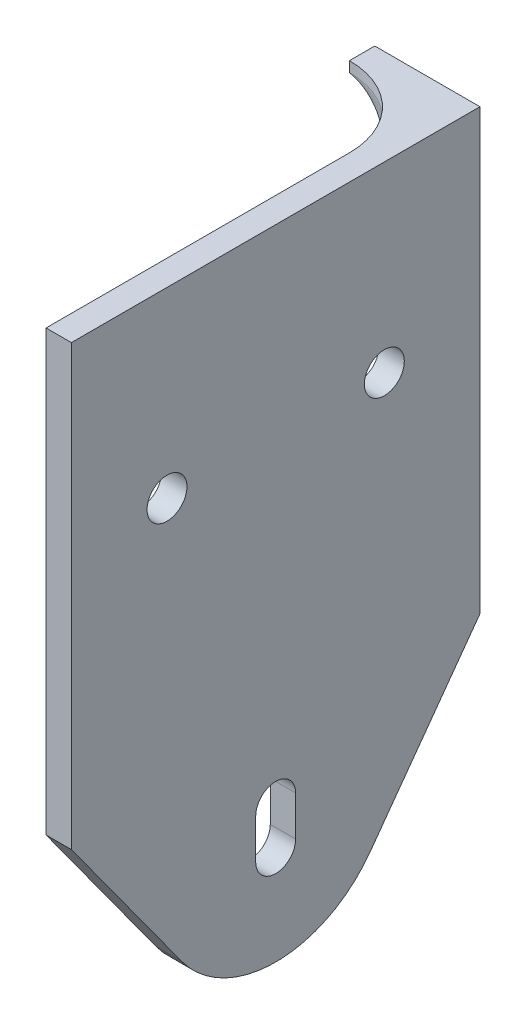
SolidWorks part; units mm, degrees
ref_plane "Front Plane" through (0, 0, 0) normal (0, 0, 1) x (1, 0, 0)
ref_plane "Top Plane" through (0, 0, 0) normal (0, 1, 0) x (1, 0, 0)
ref_plane "Right Plane" through (0, 0, 0) normal (1, 0, 0) x (0, 0, -1)
sketch "Sketch1" plane through (0, 0, 0) normal (0, 0, 1) x (1, 0, 0)
  line L0 (12, -6.3137) -> (12, 6.3)
  line L1 (5.952, 6.3) -> (12, 6.3)
  line L4 (12.1714, -7.3385) -> (12.1693, -6.3137) construction
  line L10 (-10.2132, 6.3) -> (10.2132, 6.3) construction
  line L12 (5.952, 6.3) -> (5.952, -6.3137)
  line L13 (5.952, -6.3137) -> (12.1693, -6.3137)
  line L21 (10.2132, -6.3) -> (11.9128, -6.3137) construction
  line L22 (12, 6.3) -> (15.175, 6.3)
  line L30 (10, -242.35) -> (10, -27.35) construction
  line L31 (10.0001, 6.3) -> (10.2132, 6.3) construction
  line L32 (11.9128, -6.3137) -> (8.8715, -6.3137) construction
  line L33 (12.1693, -6.3137) -> (12, -6.3137) construction
  line L34 (11, -242.35) -> (11, -27.35) construction
  line L35 (0, 6.3) -> (0, 5.1)
  line L36 (11, -73.7) -> (14.175, -73.7)
  line L37 (11, -73.7) -> (11, 6.3)
  line L38 (11, 6.3) -> (14.175, 6.3)
  line L39 (14.175, -73.7) -> (14.175, 6.3)
  line L40 (0, 6.3) -> (5.952, 6.3)
  line L41 (1, 6.3) -> (1, -7.9111)
  line L42 (5.952, -6.3137) -> (1, -6.3)
  arc A1 (10.2132, -6.3) -> (10.2132, 6.3) centre (0, 0) ccw construction
  circle A4 centre (9, 0) radius 1.5
  circle A6 centre (0, 0) radius 5.1
  dimension "D2" = 1
  dimension "D3" = 3.175
  dimension "D4" = 80
  dimension "D5" = 1
extrude "Boss-Extrude1" add sketch "Sketch1" along normal blind 3.175
sketch "Sketch2" plane through (0, 0, 3.175) normal (0, 0, 1) x (1, 0, 0)
  line L1 (11, -73.7) -> (14.175, -73.7)
  line L2 (11, -73.7) -> (11, 6.3)
  line L3 (11, 6.3) -> (14.175, 6.3)
  line L4 (14.175, -73.7) -> (14.175, 6.3)
  dimension "D1" = 80
  dimension "D2" = 3.175
extrude "Boss-Extrude2" add sketch "Sketch2" along normal blind 48
sketch "Sketch3" plane through (14.175, 0, 0) normal (1, 0, 0) x (0, 0, -1)
  line L0 (-51.175, -73.7) -> (0, -73.7) construction
  line L2 (-25.5875, 6.3) -> (-25.5875, -73.7) construction
  line L3 (-51.175, 6.3) -> (0, 6.3) construction
  line L4 (0, -73.7) -> (0, 6.3) construction
  line L5 (0, -17.3318) -> (-11.4305, -62.6693)
  line L8 (-25.5875, -56.6) -> (-25.5875, -61.6) construction
  line L9 (-23.0875, -56.6) -> (-23.0875, -61.6)
  line L10 (-28.0875, -56.6) -> (-28.0875, -61.6)
  line L11 (-51.175, -15.7974) -> (-39.7718, -62.559)
  line L12 (-51.175, -73.7) -> (-51.175, 6.3) construction
  line L23 (0, 6.3) -> (-51.175, 6.3)
  line L24 (-51.175, 6.3) -> (-51.175, -73.7)
  line L25 (-51.175, -73.7) -> (0, -73.7)
  circle A0 centre (-11.9754, -16.5646) radius 12 construction
  circle A1 centre (-39.1996, -16.5646) radius 12 construction
  circle A2 centre (-39.1996, -16.5646) radius 2.5
  circle A3 centre (-11.9754, -16.5646) radius 2.5
  circle A4 centre (-25.5875, -59.1) radius 12 construction
  arc A5 (-23.0875, -56.6) -> (-28.0875, -56.6) centre (-25.5875, -56.6) ccw
  arc A6 (-28.0875, -61.6) -> (-23.0875, -61.6) centre (-25.5875, -61.6) ccw
  circle A7 centre (-25.5875, -59.1) radius 14.6
  point P22 (-25.5875, -59.1)
  dimension "D1" = 24
  dimension "D3" = 5
  dimension "D4" = 5
  dimension "D5" = 24
  dimension "D6" = 2.5
  dimension "D8" = 29.2
  dimension "D7" = 5
extrude "Cut-Extrude1" cut sketch "Sketch3" against normal through all
fillet "Fillet1" radius 10 1 edges at (11, -0.0069, 3.175)
fillet "Fillet2" radius 15 1 edges at (12.5875, 6.3, 51.175)
fillet "Fillet3" radius 50 2 edges at (12.5875, -15.7974, 51.175) (12.5875, -17.3318, 0)
sketch "Sketch4" plane through (14.175, 0, 0) normal (1, 0, 0) x (0, 0, -1)
  line L0 (-28.0875, -56.6) -> (-28.0875, -61.6) construction
  line L1 (0, 6.3) -> (-51.175, 6.3)
  line L2 (0, 6.3) -> (0, -48.7)
  line L3 (-18.1436, -73.7) -> (-33.0314, -73.7)
  line L4 (-51.175, 6.3) -> (-51.175, -48.7)
  line L5 (-11.4305, -62.6693) -> (-1.5172, -23.3495)
  line L6 (0, -11.1259) -> (0, 6.3)
  line L7 (0, 6.3) -> (-36.175, 6.3)
  line L8 (-51.175, -8.7) -> (-51.175, -9.789)
  line L9 (-49.7515, -21.6347) -> (-39.7718, -62.559)
  line L10 (-11.4305, -62.6693) -> (-1.5172, -23.3495) construction
  line L11 (0, -11.1259) -> (0, 6.3) construction
  line L12 (0, 6.3) -> (-36.175, 6.3) construction
  line L13 (-51.175, -8.7) -> (-51.175, -9.789) construction
  line L14 (-49.7515, -21.6347) -> (-39.7718, -62.559) construction
  line L15 (-23.0875, -56.6) -> (-23.0875, -61.6) construction
  line L16 (-28.0875, -56.6) -> (-28.0875, -61.6)
  line L17 (-23.0875, -56.6) -> (-23.0875, -61.6)
  line L18 (-16.5086, -96.4667) -> (-51.175, -48.7)
  line L19 (-25.5875, 6.3) -> (-25.5875, -73.7) construction
  line L20 (-34.6664, -96.4667) -> (0, -48.7)
  line L21 (-33.0314, -73.7) -> (-51.175, -73.7) construction
  line L22 (-51.175, -48.7) -> (-51.175, -73.7) construction
  line L23 (0, -48.7) -> (0, -73.7) construction
  line L24 (0, -73.7) -> (-18.1436, -73.7) construction
  arc A0 (-23.0875, -56.6) -> (-28.0875, -56.6) centre (-25.5875, -56.6) ccw construction
  arc A1 (-28.0875, -61.6) -> (-23.0875, -61.6) centre (-25.5875, -61.6) ccw construction
  circle A2 centre (-11.9754, -16.5646) radius 2.5 construction
  circle A3 centre (-39.1996, -16.5646) radius 2.5 construction
  arc A4 (-1.5172, -23.3495) -> (0, -11.1259) centre (-50, -11.1259) ccw
  arc A5 (-36.175, 6.3) -> (-51.175, -8.7) centre (-36.175, -8.7) ccw
  arc A6 (-51.175, -9.789) -> (-49.7515, -21.6347) centre (-1.175, -9.789) ccw
  arc A7 (-39.7718, -62.559) -> (-11.4305, -62.6693) centre (-25.5875, -59.1) ccw
  arc A8 (-1.5172, -23.3495) -> (0, -11.1259) centre (-50, -11.1259) ccw construction
  arc A9 (-36.175, 6.3) -> (-51.175, -8.7) centre (-36.175, -8.7) ccw construction
  arc A10 (-51.175, -9.789) -> (-49.7515, -21.6347) centre (-1.175, -9.789) ccw construction
  arc A11 (-39.7718, -62.559) -> (-11.4305, -62.6693) centre (-25.5875, -59.1) ccw construction
  arc A12 (-23.0875, -56.6) -> (-28.0875, -56.6) centre (-25.5875, -56.6) ccw
  arc A13 (-28.0875, -61.6) -> (-23.0875, -61.6) centre (-25.5875, -61.6) ccw
  circle A14 centre (-11.9754, -16.5646) radius 2.5
  circle A15 centre (-39.1996, -16.5646) radius 2.5
  dimension "D2" = 25
  dimension "D1" = 0
extrude "Boss-Extrude3" add sketch "Sketch4" against normal up to surface (3.175 mm away) contours L18 L4 M34 M33 M32 | L20 L2 M34 M27 M26 | L1 L4 M30
